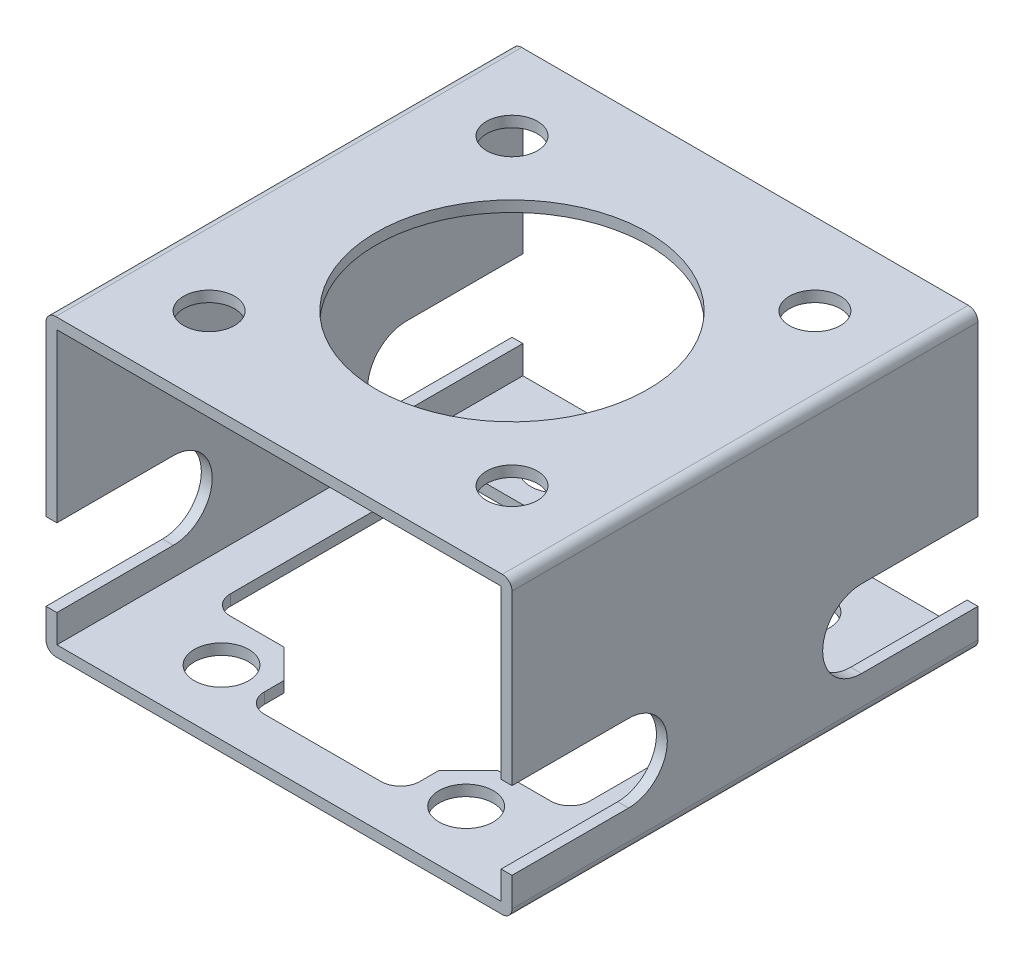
SolidWorks part; units mm, degrees
ref_plane "Front Plane" through (0, 0, 0) normal (0, 0, 1) x (1, 0, 0)
ref_plane "Top Plane" through (0, 0, 0) normal (0, 1, 0) x (1, 0, 0)
ref_plane "Right Plane" through (0, 0, 0) normal (1, 0, 0) x (0, 0, -1)
sketch "Sketch1" plane through (0, 0, 0) normal (0, 0, 1) x (1, 0, 0)
  line L0 (1.778, 1.778) -> (74.422, 1.778)
  line L1 (1.5875, 0) -> (74.6125, 0)
  line L2 (0, 1.5875) -> (0, 46.5963)
  line L3 (1.5875, 48.1838) -> (74.6125, 48.1838)
  line L4 (76.2, 1.5875) -> (76.2, 46.5963)
  line L5 (74.422, 1.778) -> (74.422, 46.4058)
  line L6 (1.778, 46.4058) -> (74.422, 46.4058)
  line L7 (1.778, 1.778) -> (1.778, 46.4058)
  arc A0 (1.5875, 48.1838) -> (0, 46.5963) centre (1.5875, 46.5963) ccw
  arc A1 (76.2, 46.5963) -> (74.6125, 48.1838) centre (74.6125, 46.5963) ccw
  arc A2 (74.6125, 0) -> (76.2, 1.5875) centre (74.6125, 1.5875) ccw
  arc A3 (1.5875, 0) -> (0, 1.5875) centre (1.5875, 1.5875) cw
  arc A4 (74.422, 1.778) -> (74.422, 1.778) centre (74.422, 1.778) ccw
  arc A5 (74.422, 46.4058) -> (74.422, 46.4058) centre (74.422, 46.4058) ccw
  arc A6 (1.778, 46.4058) -> (1.778, 46.4058) centre (1.778, 46.4058) ccw
  arc A7 (1.778, 1.778) -> (1.778, 1.778) centre (1.778, 1.778) cw
  point P6 (0, 48.1838)
  point P11 (76.2, 0)
  point P14 (0, 0)
  dimension "D3" = 1.5875
  dimension "D1" = 48.1838
  dimension "D2" = 76.2
  dimension "D4" = 1.778
extrude "Extrude1" add sketch "Sketch1" against normal mid plane 76.2
sketch "Sketch2" plane through (0, 0, 0) normal (1, 0, 0) x (0, 0, -1)
  line L0 (-38.1, 19.05) -> (-19.05, 19.05)
  line L2 (-19.05, 6.35) -> (-38.1, 6.35)
  line L3 (-47.7856, 12.7) -> (-8.2461, 12.7) construction
  line L4 (38.1, 0) -> (-38.1, 0) construction
  line L5 (-38.1, 1.5875) -> (-38.1, 46.5963) construction
  line L6 (-38.1, 6.35) -> (-38.1, 19.05)
  arc A0 (-19.05, 6.35) -> (-19.05, 19.05) centre (-19.05, 12.7) ccw
  dimension "D2" = 6.35
  dimension "D3" = 19.05
  dimension "D1" = 12.7
extrude "Cut-Extrude4" cut sketch "Sketch2" along normal through all
mirror "Mirror1" about plane through (0, 0, 0) normal (0, 0, 1) of "Cut-Extrude4"
sketch "Sketch3" plane through (0, 48.1838, 0) normal (0, 1, 0) x (-1, 0, 0)
  line L0 (-38.1, 38.1) -> (-38.1, -38.1) construction
  line L1 (-74.6125, 38.1) -> (-1.5875, 38.1) construction
  line L2 (-74.6125, -38.1) -> (-1.5875, -38.1) construction
  line L3 (0, 0) -> (-76.2, 0) construction
  line L4 (0, -38.1) -> (0, 38.1) construction
  line L5 (-76.2, -38.1) -> (-76.2, 38.1) construction
  circle A0 centre (-38.1, 0) radius 22.225
  circle A1 centre (-13.335, -24.765) radius 4.1656
  circle A2 centre (-62.865, -24.765) radius 4.1656
  circle A3 centre (-62.865, 24.765) radius 4.1656
  circle A4 centre (-13.335, 24.765) radius 4.1656
  dimension "D1" = 44.45
  dimension "D2" = 8.3312
  dimension "D3" = 49.53
  dimension "D4" = 49.53
extrude "Cut-Extrude5" cut sketch "Sketch3" against normal blind 1.778
sketch "Sketch4" plane through (0, 0, 0) normal (0, -1, 0) x (1, 0, 0)
  line L0 (38.1, 38.1) -> (38.1, -38.1) construction
  line L3 (1.5875, 38.1) -> (74.6125, 38.1) construction
  line L4 (1.5875, -38.1) -> (74.6125, -38.1) construction
  line L5 (0, 0) -> (76.2, 0) construction
  line L6 (0, -38.1) -> (0, 38.1) construction
  line L7 (76.2, -38.1) -> (76.2, 38.1) construction
  circle A0 centre (18.1, 27.5) radius 4.445
  circle A1 centre (58.1, 27.5) radius 4.445
  circle A2 centre (58.1, -27.5) radius 4.445
  circle A3 centre (18.1, -27.5) radius 4.445
  dimension "D3" = 8.89
  dimension "D1" = 40
  dimension "D2" = 55
extrude "Cut-Extrude6" cut sketch "Sketch4" against normal blind 1.778
sketch "Sketch5" plane through (0, 0, 0) normal (0, -1, 0) x (1, 0, 0)
  line L0 (38.1, 38.1) -> (38.1, -38.1) construction
  line L1 (1.5875, 38.1) -> (74.6125, 38.1) construction
  line L2 (1.5875, -38.1) -> (74.6125, -38.1) construction
  line L3 (0, 0) -> (76.2, 0) construction
  line L4 (0, -38.1) -> (0, 38.1) construction
  line L5 (76.2, -38.1) -> (76.2, 38.1) construction
  line L6 (8.7312, 19.8438) -> (20.6375, 19.8437)
  line L7 (25.4, 30.9562) -> (50.8, 30.9562)
  line L8 (25.4, -30.9562) -> (50.8, -30.9562)
  line L9 (25.4, 30.9562) -> (25.4, 24.6062)
  line L10 (8.7312, 19.8438) -> (8.7312, -19.8438)
  line L11 (67.4688, 19.8438) -> (67.4688, -19.8438)
  line L12 (25.4, 24.6062) -> (20.6375, 19.8437)
  line L13 (50.8, 30.9562) -> (50.8, 24.6063)
  line L14 (50.8, 24.6063) -> (55.5625, 19.8438)
  line L15 (67.4688, 19.8438) -> (55.5625, 19.8438)
  line L16 (67.4688, -19.8438) -> (55.5625, -19.8438)
  line L17 (50.8, -24.6063) -> (55.5625, -19.8438)
  line L18 (50.8, -30.9562) -> (50.8, -24.6063)
  line L19 (25.4, -30.9562) -> (25.4, -24.6063)
  line L20 (8.7312, -19.8438) -> (20.6375, -19.8438)
  line L21 (25.4, -24.6063) -> (20.6375, -19.8438)
  circle A0 centre (38.1, 0) radius 28.575 construction
  point P16 (38.1, 30.9562)
  point P22 (8.7312, 0)
  dimension "D1" = 57.15
  dimension "D2" = 61.9125
  dimension "D3" = 25.4
  dimension "D4" = 39.6875
  dimension "D5" = 58.7375
  dimension "D6" = 45
  dimension "D7" = 4.7625
extrude "Cut-Extrude7" cut sketch "Sketch5" against normal blind 1.778
fillet "Fillet1" radius 3.175 8 edges at (67.4688, 0.889, -19.8438) (50.8, 0.889, -30.9562) (67.4688, 0.889, 19.8438) (50.8, 0.889, 30.9562) (25.4, 0.889, -30.9562) (8.7312, 0.889, -19.8438) (8.7312, 0.889, 19.8438) (25.4, 0.889, 30.9562)
